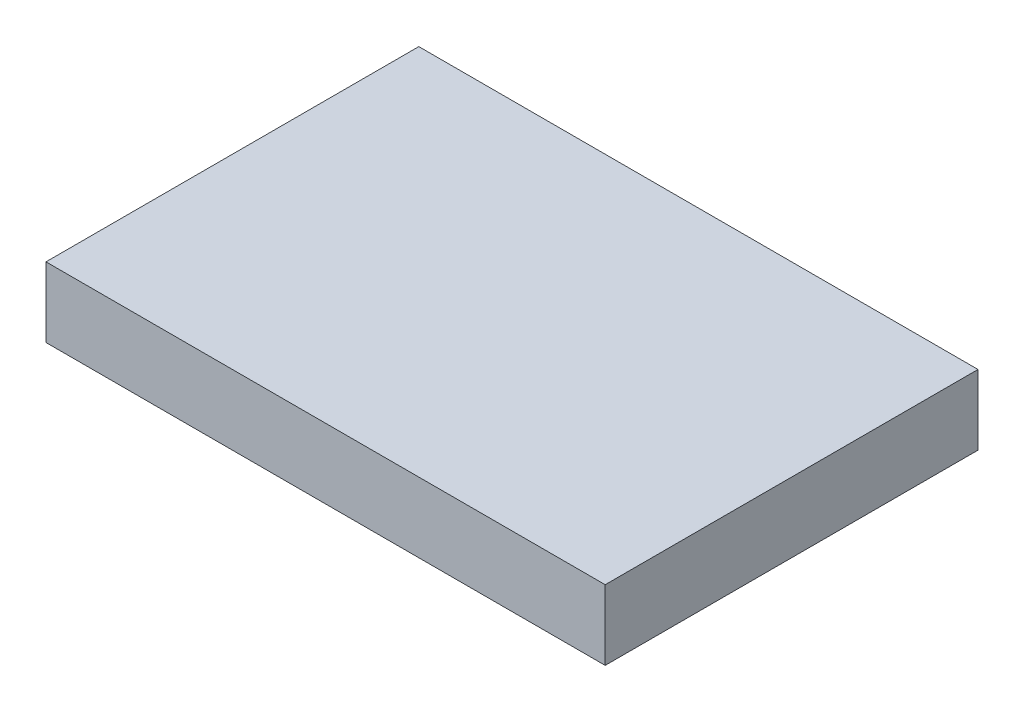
SolidWorks part; units mm, degrees
ref_plane "Front Plane" through (0, 0, 0) normal (0, 0, 1) x (1, 0, 0)
ref_plane "Top Plane" through (0, 0, 0) normal (0, 1, 0) x (1, 0, 0)
ref_plane "Right Plane" through (0, 0, 0) normal (1, 0, 0) x (0, 0, -1)
sketch "Sketch1" plane through (0, 0, 0) normal (0, 1, 0) x (1, 0, 0)
  line L1 (0, 0) -> (152.4, 0)
  line L2 (0, 0) -> (0, 101.6)
  line L3 (0, 101.6) -> (152.4, 101.6)
  line L4 (152.4, 0) -> (152.4, 101.6)
  dimension "D1" = 152.4
  dimension "D2" = 101.6
extrude "Extrude1" add sketch "Sketch1" along normal blind 19.05
